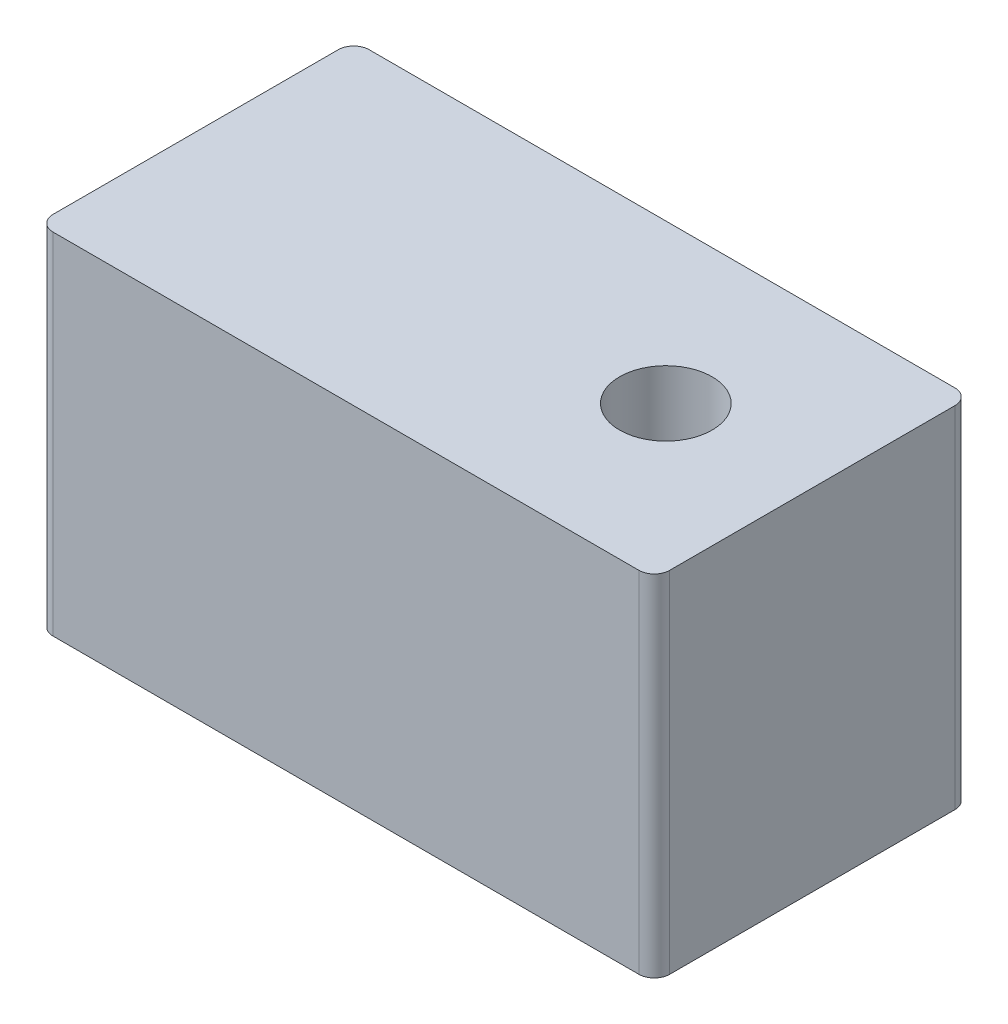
SolidWorks part; units mm, degrees
ref_plane "Přední" through (0, 0, 0) normal (0, 0, 1) x (1, 0, 0)
ref_plane "Horní" through (0, 0, 0) normal (0, 1, 0) x (1, 0, 0)
ref_plane "Pravá" through (0, 0, 0) normal (1, 0, 0) x (0, 0, -1)
sketch "Skica1" plane through (0, 0, 0) normal (0, 1, 0) x (1, 0, 0)
  line L0 (0, 21.8461) -> (0, -13.7975) construction
  line L1 (-25.2955, 0) -> (24.7206, 0) construction
  line L2 (-19, 10.25) -> (19, 10.25)
  line L3 (20, 9.25) -> (20, -9.25)
  line L4 (-20, 9.25) -> (-20, -9.25)
  line L5 (-19, -10.25) -> (19, -10.25)
  arc A0 (19, 10.25) -> (20, 9.25) centre (19, 9.25) cw
  arc A1 (-19, 10.25) -> (-20, 9.25) centre (-19, 9.25) ccw
  arc A2 (20, -9.25) -> (19, -10.25) centre (19, -9.25) cw
  arc A3 (-20, -9.25) -> (-19, -10.25) centre (-19, -9.25) ccw
  point P8 (0, 10.25)
  dimension "D1" = 1
  dimension "D2" = 40
  dimension "D3" = 20.5
extrude "Základ-Protažení" add sketch "Skica1" along normal blind 22.7
sketch "Skica2" plane through (0, 22.7, 0) normal (0, 1, 0) x (-1, 0, 0)
  line L0 (0, 0) -> (17.4601, 0) construction
  line L1 (0, 12.2603) -> (0, -16.0227) construction
  line L2 (-20, 9.25) -> (-20, -9.25) construction
  circle A0 centre (-10.5, 0) radius 3
  circle A1 centre (10.5, 0) radius 3 construction
  dimension "D1" = 9.5
  dimension "D2" = 6
  dimension "D3" = 21
extrude "Odebrat vysunutím1" cut sketch "Skica2" against normal blind 10
